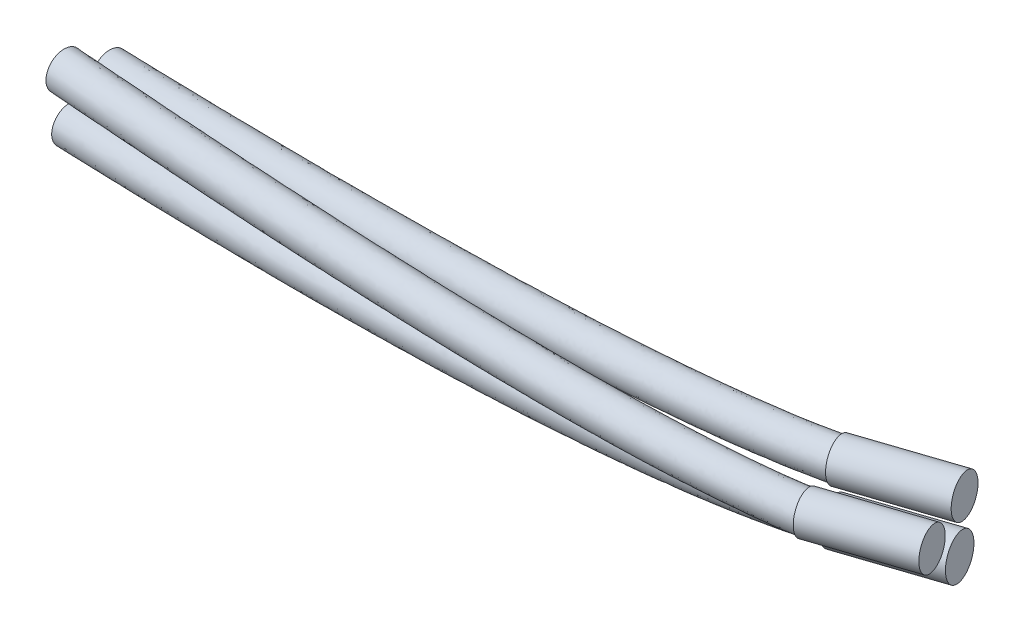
SolidWorks part; units mm, degrees
ref_plane "Спереди" through (0, 0, 0) normal (0, 0, 1) x (1, 0, 0)
ref_plane "Сверху" through (0, 0, 0) normal (0, 1, 0) x (1, 0, 0)
ref_plane "Справа" through (0, 0, 0) normal (1, 0, 0) x (0, 0, -1)
sketch "Эскиз1" plane through (0, 0, 0) normal (0, 1, 0) x (1, 0, 0)
  spline S0 degree 2 poles (0, 2.0582) (36.6709, 0.5284) (50, 4.0038) knots 0 0 0 1 1 1
  point P5 (0, 0)
sketch "Эскиз2" plane through (0, 0, 0) normal (1, 0, 0) x (0, 0, -1)
  circle A0 centre (0.9906, 2.4224) radius 1.25
  circle A1 centre (1.3842, -0.9991) radius 1.25
  circle A2 centre (4.1271, 0.7944) radius 1.25
  point P6 (1.4947, 1.9041)
  point P7 (1.3842, -0.9991)
  point P8 (4.1271, 0.7944)
  point P9 (0.9906, 2.4224)
sweep "По траектории1" add profiles "Эскиз2" path "Эскиз1" parameters "D4"=45
sketch "Эскиз3" plane through (47.0976, 1.4468, -13.7751) normal (0.9594, 0.0295, -0.2806) x (-0.2805, -0.0086, -0.9598)
  circle A0 centre (-9.9408, -2.7164) radius 1.4466
extrude "Бобышка-Вытянуть1" add sketch "Эскиз3" along normal blind 7
sketch "Эскиз5" plane through (47.0976, 1.4468, -13.7751) normal (0.9594, 0.0295, -0.2806) x (-0.2805, -0.0086, -0.9598)
  circle A0 centre (-9.2957, 0.4967) radius 1.364
extrude "Бобышка-Вытянуть4" add sketch "Эскиз5" along normal blind 7 contours A0
sketch "Эскиз6" plane through (47.0976, 1.4468, -13.7751) normal (0.9594, 0.0295, -0.2806) x (-0.2805, -0.0086, -0.9598)
  circle A0 centre (-12.656, -0.5975) radius 1.3411
extrude "Бобышка-Вытянуть5" add sketch "Эскиз6" along normal blind 7
